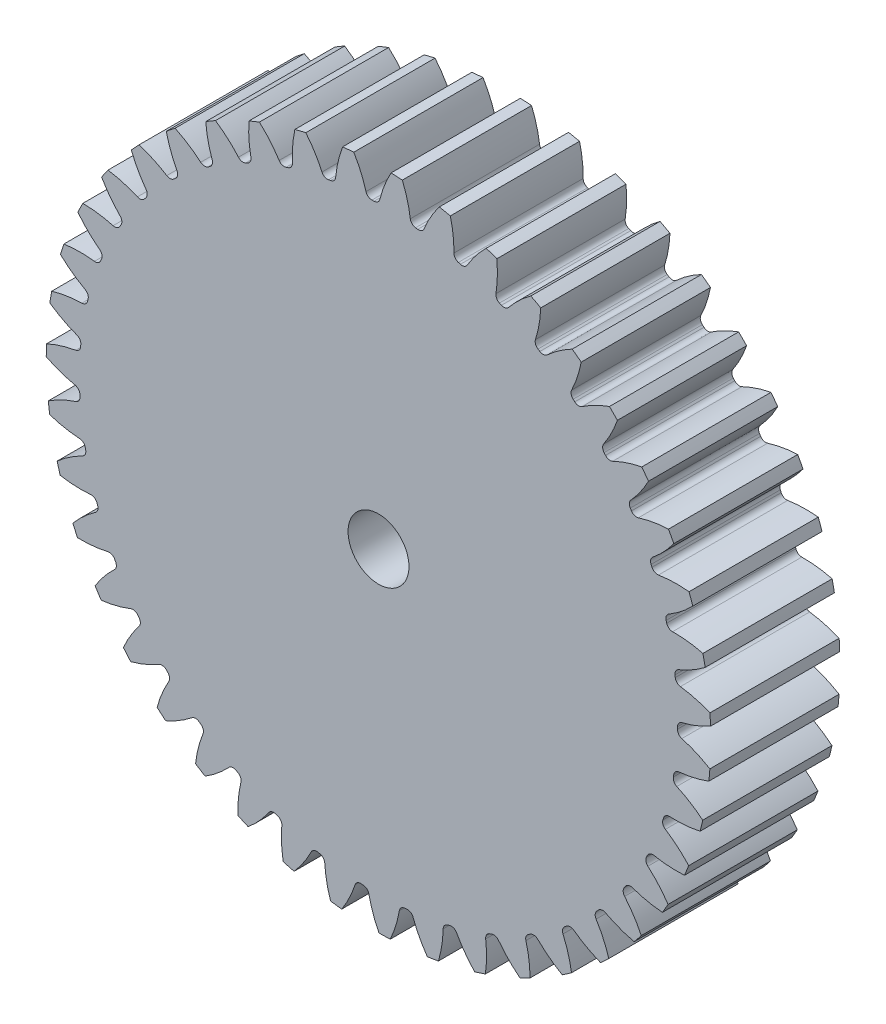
SolidWorks part; units mm, degrees
ref_plane "Front" through (0, 0, 0) normal (0, 0, 1) x (1, 0, 0)
ref_plane "Top" through (0, 0, 0) normal (0, 1, 0) x (1, 0, 0)
ref_plane "Right" through (0, 0, 0) normal (1, 0, 0) x (0, 0, -1)
sketch "Sketch3" plane through (0, 0, 0) normal (0, 0, 1) x (1, 0, 0)
  circle A0 centre (0, 0) radius 228.6
  dimension "od" = 457.2
extrude "gearBody" add sketch "Sketch3" along normal blind 88.9
sketch "Sketch2" plane through (0, 0, 0) normal (0, 0, 1) x (1, 0, 0)
  line L0 (0, 0) -> (189.6415, 78.5521) construction
  line L1 (228.1294, -17.0744) -> (0, 0) construction
  line L2 (0, 0) -> (36.3143, 0) construction
  line L3 (218.4039, 3.97) -> (218.1143, -11.9238) construction
  line L5 (218.2591, -3.9769) -> (0, 0) construction
  line L7 (0, 0) -> (205.2665, 0) construction
  arc A0 (205.2664, 0.158) -> (205.1244, -7.6357) centre (0, 0) ccw construction
  arc A1 (228.4359, 8.661) -> (227.9687, -16.9772) centre (0, 0) ccw construction
  arc A2 (218.4039, 3.97) -> (218.1143, -11.9238) centre (0, 0) ccw construction
  arc A3 (205.6907, -4.503) -> (205.7182, -2.9933) centre (0, 0) ccw
  arc A4 (228.1294, -17.0744) -> (208.6852, -8.5685) centre (186.6539, -85.4086) ccw
  arc A5 (228.1294, -17.0744) -> (228.6, 8.7523) centre (0, 0) ccw
  arc A6 (228.6, 8.7523) -> (208.8588, 0.9604) centre (189.6415, 78.5521) cw
  arc A7 (205.7182, -2.9933) -> (208.8588, 0.9604) centre (209.8529, -3.0534) cw
  arc A8 (208.6852, -8.5685) -> (205.6907, -4.503) centre (209.8248, -4.5935) cw
  point P6 (228.6, 8.7523)
  point P22 (228.1294, -17.0744)
  dimension "baseDia" = 410.5329
  dimension "od" = 457.2
  dimension "pd" = 436.88
  dimension "rd" = 411.48
  dimension "rFillet" = 4.1351
  dimension "pointX" = 228.6
  dimension "pointY" = 8.7523
  dimension "CTT" = 15.8937
  dimension "flankCenterAngle" = 22.5
extrude "toothCut" cut sketch "Sketch2" along normal through all
pattern_circular "CirPattern1" count 43 over 360 about axis through (0, 0, 0) along (0, 0, 1) of "toothCut"
sketch "hub1Dia" plane through (0, 0, 0) normal (0, 0, -1) x (-1, 0, 0)
  circle A0 centre (0, 0) radius 12.7
  dimension "hub1Dia" = 25.4
sketch "hub2Dia" plane through (0, 0, 88.9) normal (0, 0, 1) x (1, 0, 0)
  circle A0 centre (0, 0) radius 12.7
  dimension "hub2dia" = 25.4
sketch "boreDia" plane through (0, 0, 0) normal (0, 0, 1) x (1, 0, 0)
  circle A0 centre (0, 0) radius 20.955
  dimension "boreDia" = 41.91
extrude "bore" cut sketch "boreDia" against normal mid plane 25400
